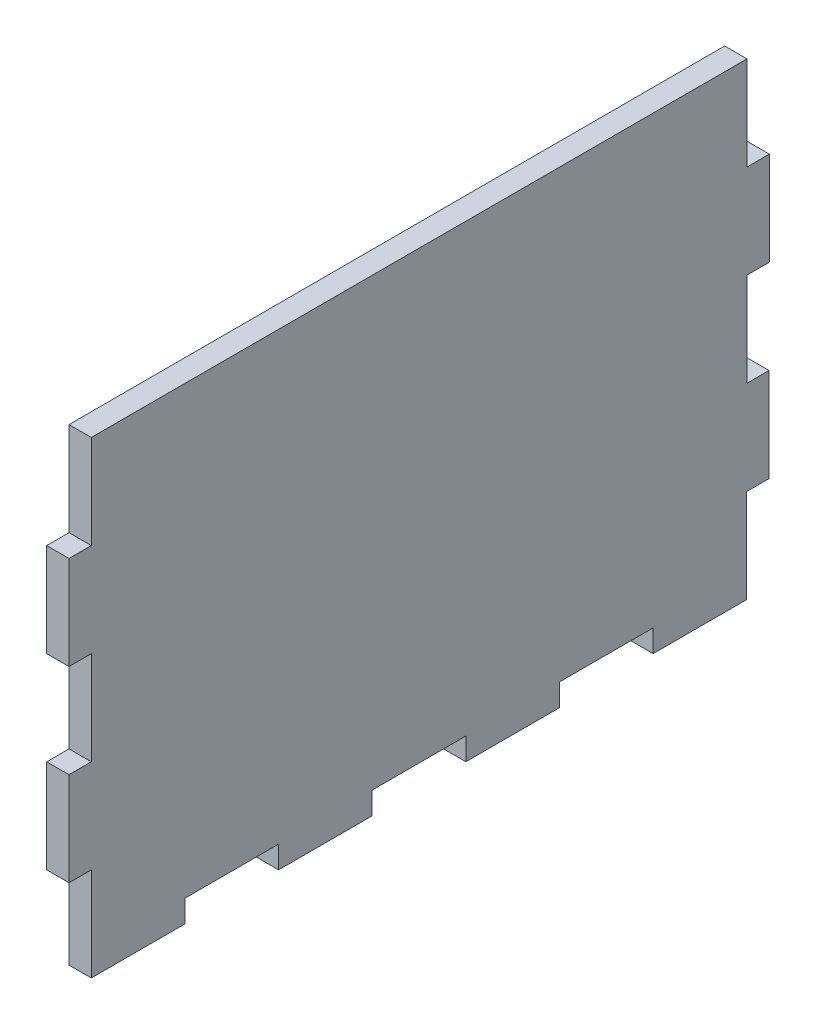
SolidWorks part; units mm, degrees
ref_plane "Front Plane" through (0, 0, 0) normal (0, 0, 1) x (1, 0, 0)
ref_plane "Top Plane" through (0, 0, 0) normal (0, 1, 0) x (1, 0, 0)
ref_plane "Right Plane" through (0, 0, 0) normal (1, 0, 0) x (0, 0, -1)
sketch "Sketch2" plane through (0, 0, 0) normal (1, 0, 0) x (0, 0, -1)
  line L0 (0, 0) -> (32.004, 0)
  line L1 (32.004, 0) -> (32.004, 7.62)
  line L2 (32.004, 7.62) -> (64.008, 7.62)
  line L3 (64.008, 7.62) -> (64.008, 0)
  line L4 (64.008, 0) -> (96.012, 0)
  line L5 (96.012, 0) -> (96.012, 7.62)
  line L6 (96.012, 7.62) -> (128.016, 7.62)
  line L7 (128.016, 7.62) -> (128.016, 0)
  line L8 (128.016, 0) -> (160.02, 0)
  line L9 (160.02, 0) -> (160.02, 7.62)
  line L10 (160.02, 7.62) -> (192.024, 7.62)
  line L11 (192.024, 7.62) -> (192.024, 0)
  line L12 (192.024, 0) -> (224.028, 0)
  line L13 (0, 0) -> (0, 32)
  line L14 (0, 32) -> (-7.62, 32)
  line L15 (-7.62, 32) -> (-7.62, 64)
  line L16 (-7.62, 64) -> (0, 64)
  line L17 (0, 64) -> (0, 96)
  line L18 (0, 96) -> (-7.62, 96)
  line L19 (-7.62, 96) -> (-7.62, 128)
  line L20 (-7.62, 128) -> (0, 128)
  line L21 (0, 128) -> (0, 160)
  line L22 (0, 160) -> (224.1207, 160)
  line L32 (224.028, 0) -> (224.028, 32)
  line L33 (224.028, 32) -> (231.648, 32)
  line L34 (231.648, 32) -> (231.648, 64)
  line L35 (231.648, 64) -> (224.1207, 64)
  line L36 (224.1207, 64) -> (224.1207, 96)
  line L37 (224.1207, 96) -> (231.7407, 96)
  line L38 (231.7407, 96) -> (231.7407, 128)
  line L39 (231.7407, 128) -> (224.1207, 128)
  line L40 (224.1207, 128) -> (224.1207, 160)
  dimension "D3" = 32.004
  dimension "D4" = 7.62
  dimension "D5" = 224.028
  dimension "D6" = 32.004
  dimension "D7" = 32.004
  dimension "D8" = 32.004
  dimension "D9" = 32.004
  dimension "D10" = 32
  dimension "D11" = 32
  dimension "D12" = 32
  dimension "D13" = 32
  dimension "D14" = 7.62
  dimension "D15" = 32.004
  dimension "D16" = 32.004
  dimension "D17" = 32.004
  dimension "D18" = 32
  dimension "D19" = 32
  dimension "D20" = 32
  dimension "D21" = 32
  dimension "D22" = 32
  dimension "D23" = 7.62
  dimension "D24" = 32
  dimension "D25" = 7.62
  dimension "D26" = 7.62
extrude "Boss-Extrude1" add sketch "Sketch2" along normal blind 7.62
